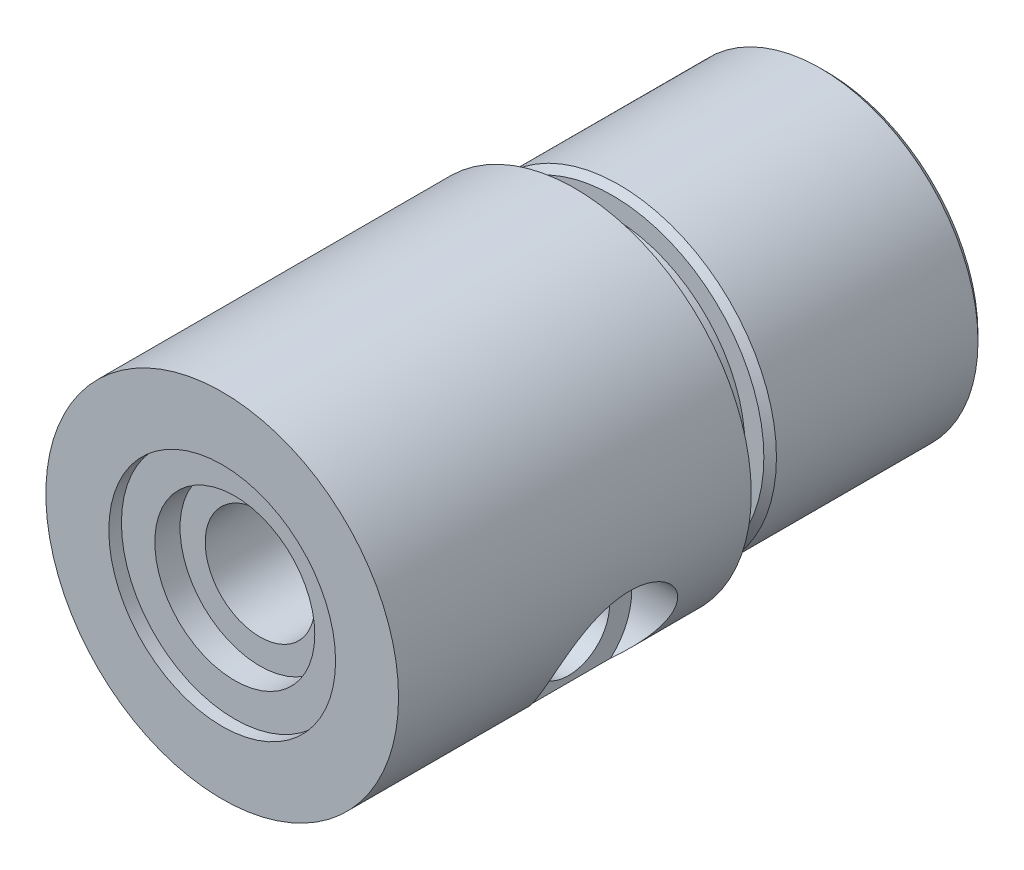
SolidWorks part; units mm, degrees
ref_plane "Front Plane" through (0, 0, 0) normal (0, 0, 1) x (1, 0, 0)
ref_plane "Top Plane" through (0, 0, 0) normal (0, 1, 0) x (1, 0, 0)
ref_plane "Right Plane" through (0, 0, 0) normal (1, 0, 0) x (0, 0, -1)
sketch "Sketch1" plane through (0, 0, 0) normal (0, 0, 1) x (1, 0, 0)
  circle A0 centre (0, 0) radius 12.5
extrude "Boss-Extrude1" add sketch "Sketch1" along normal blind 17
sketch "Sketch2" plane through (0, 0, 17) normal (0, 0, 1) x (1, 0, 0)
  circle A0 centre (0, 0) radius 10.5
extrude "Boss-Extrude2" add sketch "Sketch2" along normal blind 3
sketch "Sketch3" plane through (0, 0, 20) normal (0, 0, 1) x (1, 0, 0)
  circle A0 centre (0, 0) radius 14
extrude "Boss-Extrude3" add sketch "Sketch3" along normal blind 28
sketch "Sketch4" plane through (0, 0, 0) normal (0, 0, -1) x (-1, 0, 0)
  circle A0 centre (0, 0) radius 8
extrude "Cut-Extrude1" cut sketch "Sketch4" against normal blind 20
ref_plane "Plane1" through (14, 0, 0) normal (1, 0, 0) x (0, 0, -1)
sketch "Sketch9" plane through (14, 0, 0) normal (1, 0, 0) x (0, 0, -1)
  circle A0 centre (-29.5, -7) radius 3.25
extrude "Cut-Extrude4" cut sketch "Sketch9" against normal blind 28
sketch "Sketch11" plane through (0, 0, 20) normal (0, 0, -1) x (-1, 0, 0)
  circle A0 centre (0, -5.2309) radius 0.5
extrude "Cut-Extrude6" cut sketch "Sketch11" against normal blind 8
hole_wizard "M3 Clearance Hole1" positions "Sketch18" profile "Sketch17" hole size "M3" standard "Ansi Metric"
sketch "Sketch18" plane through (0, 0, 20) normal (0, 0, -1) x (-1, 0, 0)
  point P0 (0, -5.2309)
sketch "Sketch17" plane through (0, -5.2309, 20) normal (1, 0, 0) x (0, 1, 0)
  line L0 (0, 0) -> (0, 6.0215)
  line L1 (0, 6.0215) -> (1.7, 5)
  line L2 (1.7, 5) -> (1.7, 0)
  line L5 (1.7, 0) -> (0, 0)
  line L10 (0, 6.0215) -> (-1.7, 5) construction
  line L11 (0, -6.35) -> (0, 107.95) construction
  dimension "Hole Dia." = 3.4
  dimension "Hole Depth" = 5
  dimension "Drill Angle" = 118
chamfer "Chamfer1" distance 0.5 angle 45 1 edges at (12.5, 0, 0)
chamfer "Chamfer2" distance 0.5 angle 45 1 edges at (12.5, 0, 17)
sketch "Sketch19" plane through (14, 0, 0) normal (1, 0, 0) x (0, 0, -1)
  circle A0 centre (-29.5, -7) radius 5
extrude "Cut-Extrude7" cut sketch "Sketch19" against normal blind 5
ref_plane "Plane2" through (-14, 0, 0) normal (1, 0, 0) x (0, 0, -1)
sketch "Sketch20" plane through (-14, 0, 0) normal (1, 0, 0) x (0, 0, -1)
  circle A0 centre (-29.5, -7) radius 5
extrude "Cut-Extrude10" cut sketch "Sketch20" along normal blind 5
sketch "Sketch21" plane through (0, 0, 48) normal (0, 0, 1) x (1, 0, 0)
  circle A0 centre (0, 0) radius 9
extrude "Cut-Extrude11" cut sketch "Sketch21" against normal blind 1
sketch "Sketch23" plane through (0, 0, 20) normal (0, 0, -1) x (-1, 0, 0)
  circle A0 centre (0, 2.5) radius 0.5
extrude "Cut-Extrude13" cut sketch "Sketch23" against normal blind 15
sketch "Sketch24" plane through (0, 0, 47) normal (0, 0, 1) x (1, 0, 0)
  circle A0 centre (0, 0) radius 6.35
extrude "Cut-Extrude14" cut sketch "Sketch24" against normal blind 2
hole_wizard "Ø8.7 (8.7) Diameter Hole1" positions "Sketch26" profile "Sketch25" hole size "Ø8.7" standard "Ansi Metric"
sketch "Sketch26" plane through (0, 0, 45) normal (0, 0, 1) x (1, 0, 0)
  point P0 (0, 0)
sketch "Sketch25" plane through (0, 0, 45) normal (1, 0, 0) x (0, -1, 0)
  line L0 (0, 0) -> (0, 12.6137)
  line L1 (0, 12.6137) -> (4.35, 10)
  line L2 (4.35, 10) -> (4.35, 0)
  line L5 (4.35, 0) -> (0, 0)
  line L10 (0, 12.6137) -> (-4.35, 10) construction
  line L11 (0, -6.35) -> (0, 107.95) construction
  dimension "Hole Dia." = 8.7
  dimension "Hole Depth" = 10
  dimension "Drill Angle" = 118
